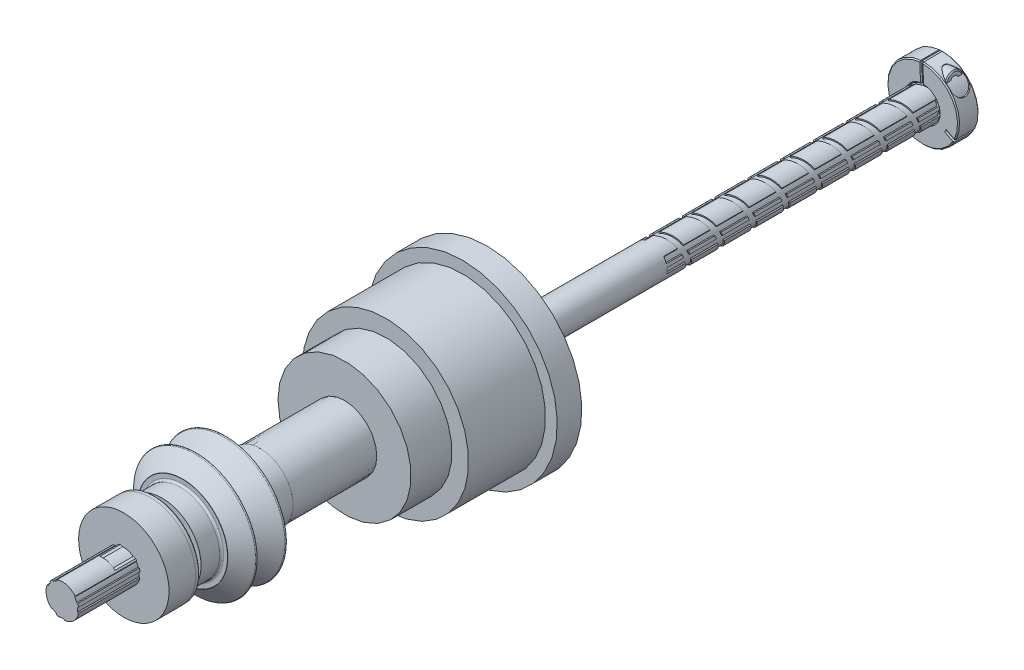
SolidWorks part; units mm, degrees
other "NONE"
ref_plane "前视基准面" through (0, 0, 0) normal (0, 0, 1) x (1, 0, 0)
ref_plane "上视基准面" through (0, 0, 0) normal (0, 1, 0) x (1, 0, 0)
ref_plane "右视基准面" through (0, 0, 0) normal (1, 0, 0) x (0, 0, -1)
imported_body "输入1"
sketch "草图1" plane through (0, 0, -86.8261) normal (0, 0, -1) x (-1, 0, 0)
  circle A0 centre (-14.4722, 16.2201) radius 8
  circle A1 centre (-14.4722, 16.2201) radius 46.3262
  circle A2 centre (-14.4722, 16.2201) radius 46.3262
  dimension "D2" = 16
  dimension "D1" = 0
extrude "切除-拉伸3" cut sketch "草图1" against normal blind 80
other "删除面1"
sketch "草图2" plane through (0, 0, 0) normal (1, 0, 0) x (0, 0, -1)
  line L0 (-151.7001, 40.1107) -> (-151.7001, -5.7981)
  line L1 (-151.7001, -5.7981) -> (-151.7001, -18.8904)
  line L2 (-151.7001, -18.8904) -> (-103.8311, -18.8904)
  line L3 (-103.8311, -18.8904) -> (-103.8311, 48.2289)
surface "曲面-拉伸1" sketch "草图2" parameters "D1"=63, "D2"=10
split "分割1" trimming surface bodies 112 bodies to split 111 resulting bodies 113 114 115
